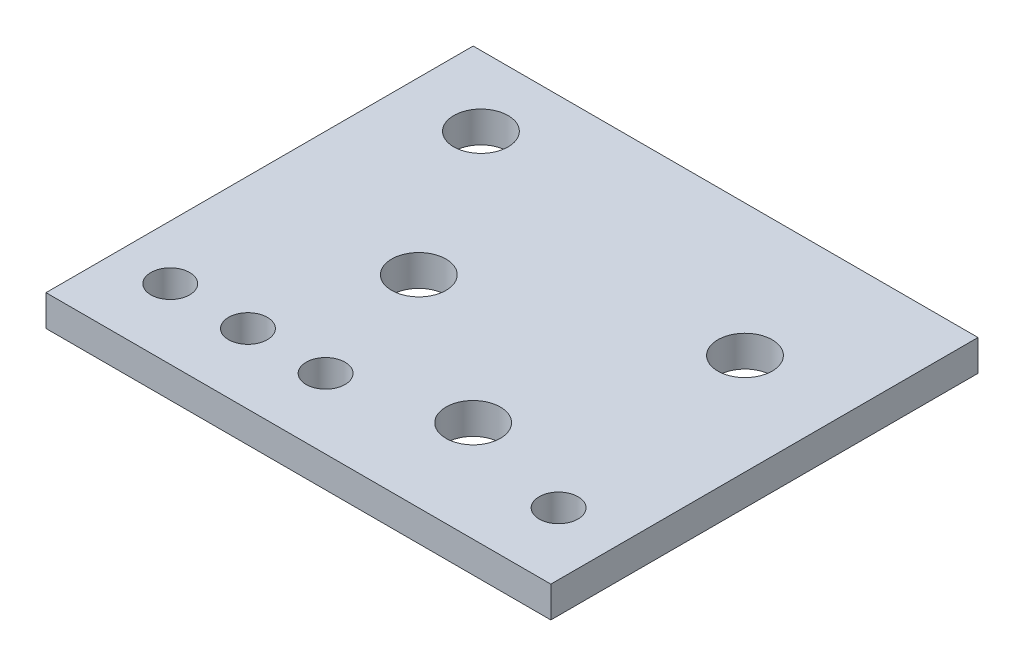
SolidWorks part; units mm, degrees
ref_plane "Front" through (0, 0, 0) normal (0, 0, 1) x (1, 0, 0)
ref_plane "Top" through (0, 0, 0) normal (0, 1, 0) x (1, 0, 0)
ref_plane "Right" through (0, 0, 0) normal (1, 0, 0) x (0, 0, -1)
sketch "Sketch1" plane through (0, 0, 0) normal (0, 1, 0) x (1, 0, 0)
  line L1 (0, 0) -> (325, 0)
  line L2 (0, 0) -> (0, 275)
  line L3 (0, 275) -> (325, 275)
  line L4 (325, 0) -> (325, 275)
  dimension "D1" = 325
  dimension "D2" = 275
extrude "Plate" add sketch "Sketch1" along normal blind 20
other "D25"
sketch "Sketch4" plane through (0, 20, 0) normal (0, 1, 0) x (-1, 0, 0)
  line L0 (0, -275) -> (0, 0) construction
  line L1 (0, 0) -> (-325, 0) construction
  circle A0 centre (-35, -45) radius 12.5
  dimension "D1" = 25
  dimension "D2" = 35
  dimension "D3" = 45
sketch "Sketch5" plane through (147.954, 20, -60.8892) normal (0, 1, 0) x (-1, 0, 0)
  line L2 (147.954, 60.8892) -> (-177.046, 60.8892) construction
  line L3 (147.954, -214.1108) -> (147.954, 60.8892) construction
  circle A0 centre (-62.046, -4.1108) radius 17.5
  dimension "D1" = 35
  dimension "D2" = 65
  dimension "D3" = 210
other "D35"
sketch "Sketch6" plane through (0, 20, 0) normal (0, 1, 0) x (-1, 0, 0)
  line L0 (-35, -45) -> (-285, -45) construction
  line L1 (0, -275) -> (0, 0) construction
  point P3 (-85, -45)
  point P4 (-135, -45)
  point P7 (-285, -45)
  dimension "D1" = 85
  dimension "D2" = 135
  dimension "D3" = 285
pattern_sketch "Sketch-Pattern1" of "D25"
other "TPattern1" parameters "D0"=50, "D1"=230, "D2"=110, "D3"=130, "D4"=260, "D5"=190
